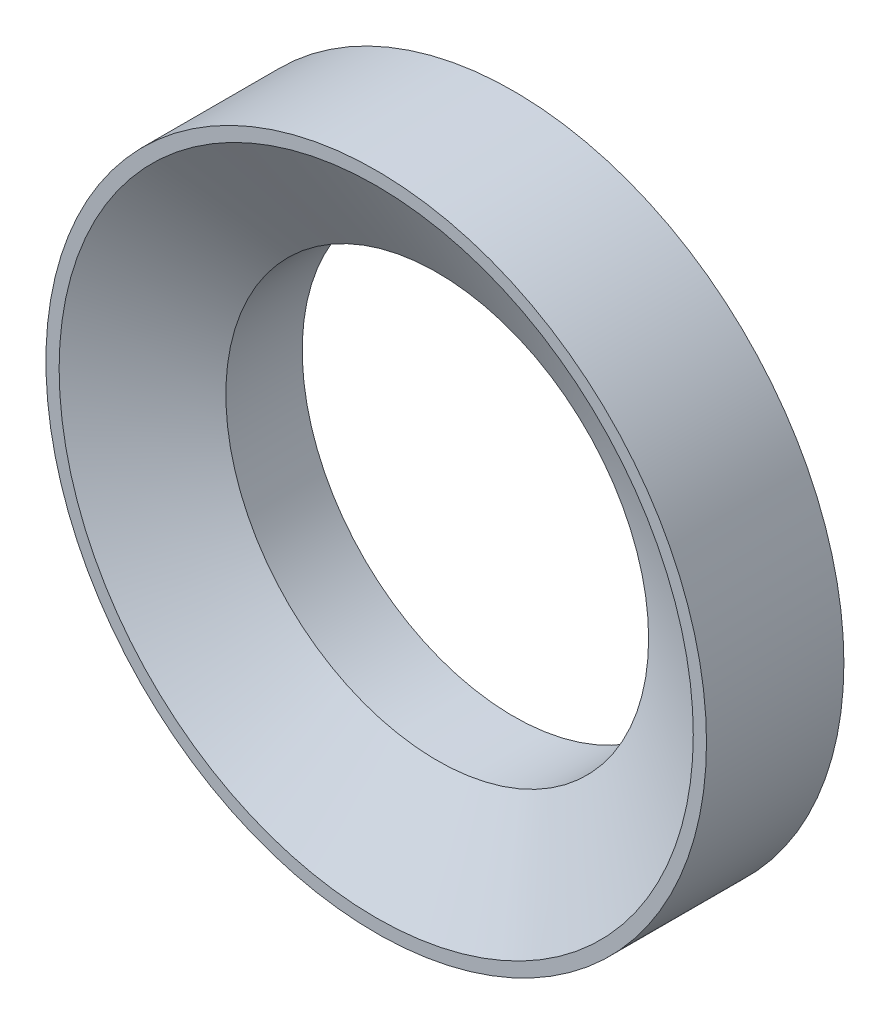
SolidWorks part; units mm, degrees
ref_plane "Front" through (0, 0, 0) normal (0, 0, 1) x (1, 0, 0)
ref_plane "Top" through (0, 0, 0) normal (0, 1, 0) x (1, 0, 0)
ref_plane "Right" through (0, 0, 0) normal (1, 0, 0) x (0, 0, -1)
other "Configuration Table"
sketch "Sketch1" plane through (0, 0, 0) normal (-1, 0, 0) x (0, -1, 0)
  line L0 (-4, -2.6) -> (-6.25, -2.6)
  line L1 (-6.25, -2.6) -> (-6.25, 0)
  line L2 (0, 12.9485) -> (0, -19.7339) construction
  line L3 (-4, -2.6) -> (-4, -1.1547)
  line L4 (-6.25, 0) -> (-6, 0)
  line L5 (-6, 0) -> (-4, -1.1547)
  dimension "D1" = 12
  dimension "D0" = 12.5
  dimension "d" = 8
  dimension "h" = 2.6
  dimension "Angle" = 60
revolve "Base-Revolve" add sketch "Sketch1" angle 360 about L2
